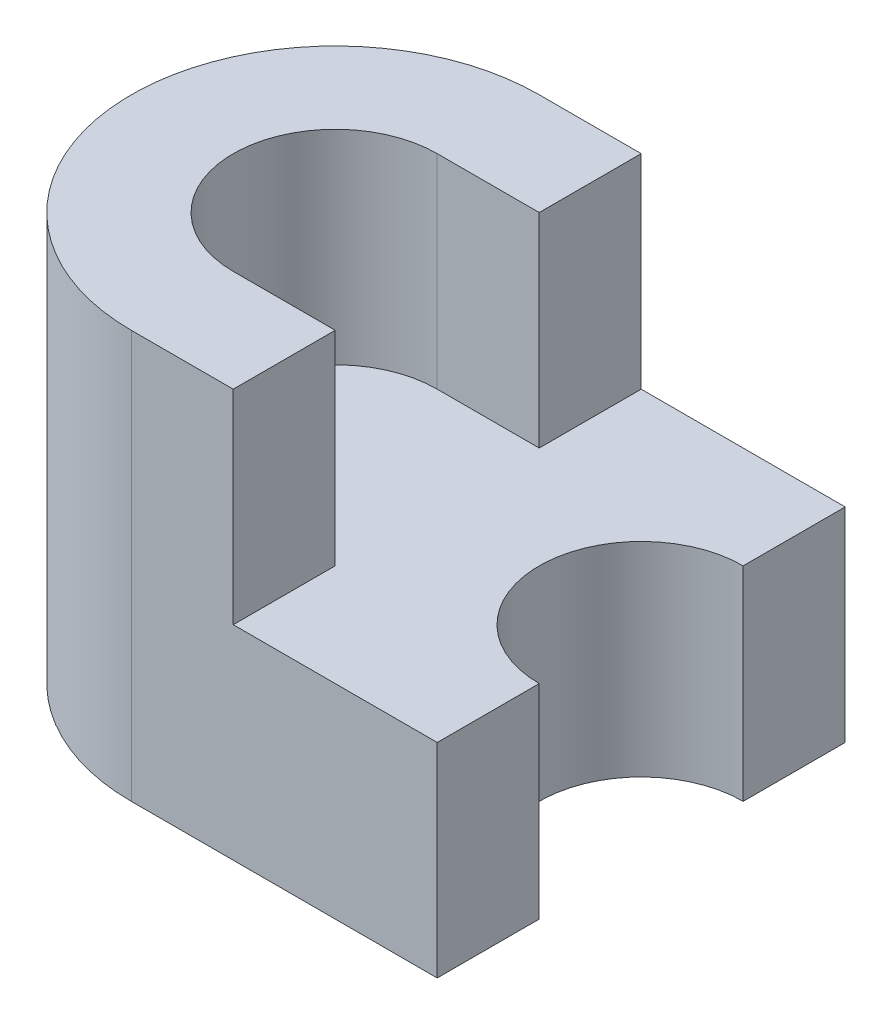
SolidWorks part; units mm, degrees
ref_plane "Front Plane" through (0, 0, 0) normal (0, 0, 1) x (1, 0, 0)
ref_plane "Top Plane" through (0, 0, 0) normal (0, 1, 0) x (1, 0, 0)
ref_plane "Right Plane" through (0, 0, 0) normal (1, 0, 0) x (0, 0, -1)
sketch "Sketch1" plane through (0, 0, 0) normal (0, 1, 0) x (1, 0, 0)
  line L0 (0, 20) -> (30, 20)
  line L1 (30, 20) -> (30, -20)
  line L2 (30, -20) -> (0, -20)
  arc A0 (0, 20) -> (0, -20) centre (0, 0) ccw
  dimension "D1" = 40
  dimension "D2" = 30
extrude "Extrude1" add sketch "Sketch1" along normal blind 20
sketch "Sketch2" plane through (0, 20, 0) normal (0, 1, 0) x (1, 0, 0)
  line L0 (0, -20) -> (10, -20)
  line L1 (0, -20) -> (30, -20) construction
  line L2 (0, 20) -> (10, 20)
  line L3 (30, 20) -> (0, 20) construction
  arc A0 (0, 20) -> (0, -20) centre (0, 0) ccw construction
  arc A1 (0, 20) -> (0, -20) centre (0, 0) ccw
  dimension "D1" = 10
extrude "Extrude-Thin1" add sketch "Sketch2" along normal blind 20 thin
sketch "Sketch3" plane through (0, 20, 0) normal (0, 1, 0) x (1, 0, 0)
  line L0 (30, -20) -> (30, 20) construction
  circle A0 centre (30, 0) radius 10
  dimension "D1" = 20
extrude "Extrude2" cut sketch "Sketch3" against normal blind 20
